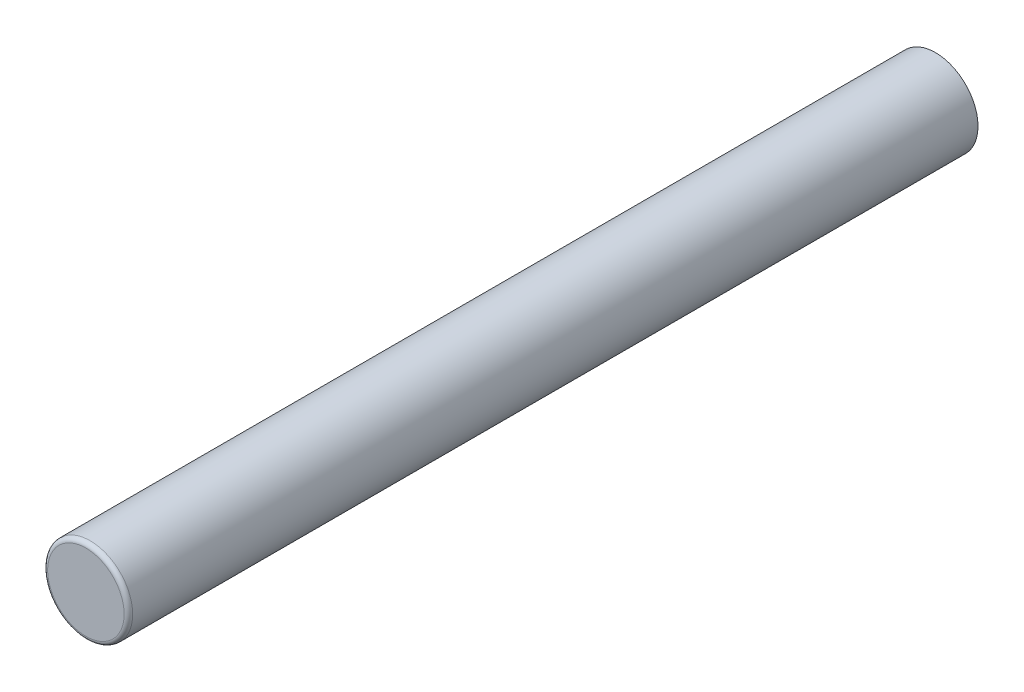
SolidWorks part; units mm, degrees
ref_plane "Front Plane" through (0, 0, 0) normal (0, 0, 1) x (1, 0, 0)
ref_plane "Top Plane" through (0, 0, 0) normal (0, 1, 0) x (1, 0, 0)
ref_plane "Right Plane" through (0, 0, 0) normal (1, 0, 0) x (0, 0, -1)
sketch "Sketch1" plane through (0, 0, 0) normal (0, 0, 1) x (1, 0, 0)
  circle A0 centre (0, 0) radius 1
  dimension "D1" = 2
extrude "Boss-Extrude1" add sketch "Sketch1" along normal mid plane 20 contours A0
fillet "Fillet1" radius 0.1 1 edges at (1, 0, 10)
